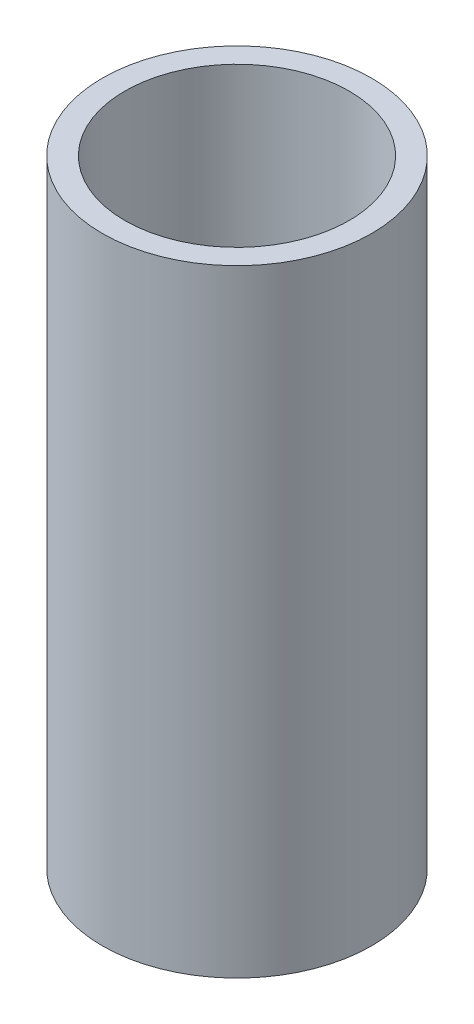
SolidWorks part; units mm, degrees
ref_plane "Front Plane" through (0, 0, 0) normal (0, 0, 1) x (1, 0, 0)
ref_plane "Top Plane" through (0, 0, 0) normal (0, 1, 0) x (1, 0, 0)
ref_plane "Right Plane" through (0, 0, 0) normal (1, 0, 0) x (0, 0, -1)
sketch "Sketch1" plane through (0, 0, 0) normal (0, 0, 1) x (1, 0, 0)
  line L0 (0, 0) -> (0, 27.5) construction
  line L1 (5, 0) -> (6, 0)
  line L2 (5, 0) -> (5, 27.5)
  line L3 (5, 27.5) -> (6, 27.5)
  line L4 (6, 0) -> (6, 27.5)
  dimension "D1" = 5
  dimension "D2" = 1
  dimension "D3" = 27.5
revolve "Revolve1" add sketch "Sketch1" angle 360 about L0
